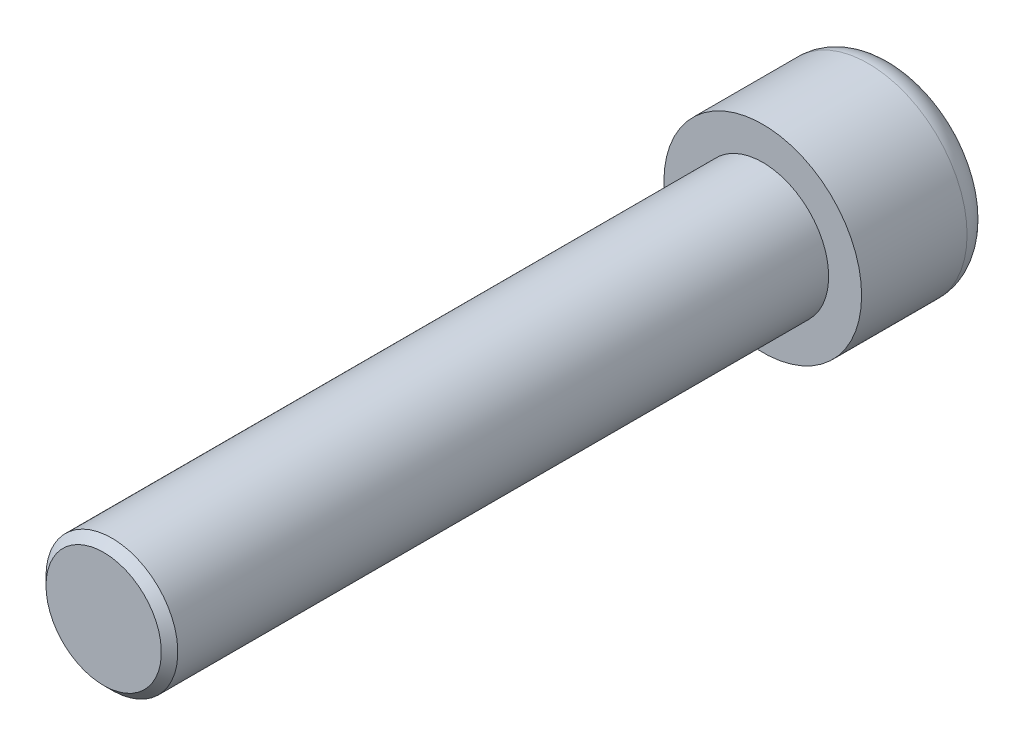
SolidWorks part; units mm, degrees
ref_plane "Plan1" through (0, 0, 0) normal (0, 0, 1) x (1, 0, 0)
ref_plane "Plan2" through (0, 0, 0) normal (0, 1, 0) x (1, 0, 0)
ref_plane "Plan3" through (0, 0, 0) normal (1, 0, 0) x (0, 0, -1)
sketch "profil tête" plane through (0, 0, 0) normal (0, 0, 1) x (1, 0, 0)
  circle A0 centre (0, 0) radius 12
  dimension "DIAMETRE" = 24
extrude "TETE" add sketch "profil tête" along normal blind 16
sketch "profil six pans" plane through (0, 0, 0) normal (0, 0, -1) x (-1, 0, 0)
  line L0 (0, 8.0829) -> (0, -8.0829) construction
  line L1 (0, 8.0829) -> (-7, 4.0415)
  line L2 (0, 8.0829) -> (7, 4.0415)
  line L3 (-7, 4.0415) -> (-7, -4.0415)
  line L4 (7, 4.0415) -> (7, -4.0415)
  line L5 (-7, -4.0415) -> (0, -8.0829)
  line L6 (7, -4.0415) -> (0, -8.0829)
  line L7 (-7, 4.0415) -> (7, -4.0415) construction
  line L8 (-7, -4.0415) -> (7, 4.0415) construction
  dimension "D1" = 60
  dimension "LARGEUR" = 14
extrude "SIX PANS" cut sketch "profil six pans" against normal blind 10
fillet "CONGE" radius 3.2 1 edges at (12, 0, 0)
sketch "profil cylindre" plane through (0, 0, 16) normal (0, 0, 1) x (1, 0, 0)
  circle A0 centre (0, 0) radius 8
  dimension "DIAMETRE" = 16
extrude "CYLINDRE FILETE" add sketch "profil cylindre" along normal blind 80
revolve "CHANFREIN FILET" cut sketch "profil chanfrein" angle 360 about L4
sketch "profil chanfrein" plane through (0, 0, 0) normal (1, 0, 0) x (0, 0, -1)
  line L0 (-96, 7) -> (-95, 8)
  line L1 (-96, 8) -> (-96, -8) construction
  line L2 (-96, 8) -> (-95, 8)
  line L3 (-16, 8) -> (-96, 8) construction
  line L4 (-12.0874, 0) -> (-18.1046, 0) construction
  line L5 (-96, 0) -> (-16, 0) construction
  line L8 (-96, 8) -> (-96, 7)
  dimension "D1" = 45
  dimension "D2" = 14
equation "\"D2@profil chanfrein\" = \"DIAMETRE FOND FILET@Représentation de filetage1\""
equation "\"HAUTEUR@TETE\"=\"DIAMETRE@profil cylindre\""
equation "\"PROFONDEUR@SIX PANS\" = \"HAUTEUR@TETE\" * 0.625"
equation "\"RAYON@CONGE\"=\"HAUTEUR@TETE\"/5"
